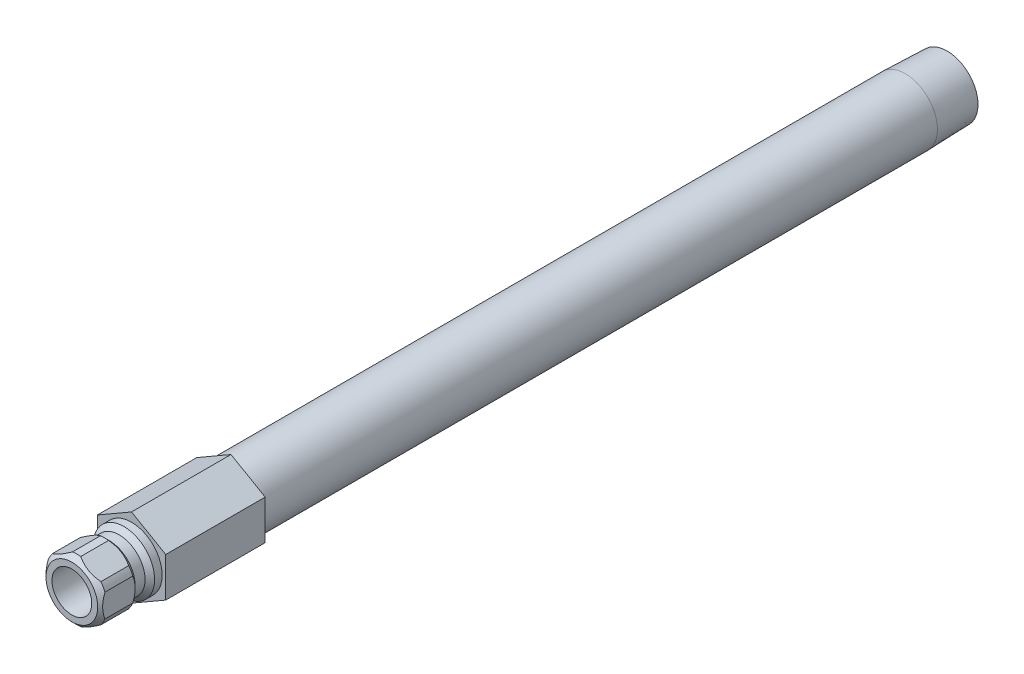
SolidWorks part; units mm, degrees
ref_plane "Front Plane" through (0, 0, 0) normal (0, 0, 1) x (1, 0, 0)
ref_plane "Top Plane" through (0, 0, 0) normal (0, 1, 0) x (1, 0, 0)
ref_plane "Right Plane" through (0, 0, 0) normal (1, 0, 0) x (0, 0, -1)
sketch "Sketch1" plane through (0, 0, 0) normal (1, 0, 0) x (0, 0, -1)
  line L0 (0, 0) -> (-12.7, 0) construction
  line L1 (-9.525, 3.175) -> (-9.525, 4.1275)
  line L2 (-3.556, 4.1275) -> (-3.556, 0) construction
  line L3 (-8.763, 4.8895) -> (-4.318, 4.8895)
  line L4 (0, 5.1435) -> (0, 3.4163) construction
  line L5 (-3.556, 4.1275) -> (-1.9685, 4.1275)
  line L6 (-1.2065, 4.8895) -> (0, 4.8895)
  line L7 (0, 4.8895) -> (0, 5.1435)
  line L8 (-3.556, 4.1275) -> (-4.318, 4.8895)
  line L9 (-1.9685, 4.1275) -> (-1.2065, 4.8895)
  line L10 (-9.525, 4.1275) -> (-8.763, 4.8895)
  line L12 (0, 5.1435) -> (123.4948, 5.1435)
  line L13 (123.4948, 5.1435) -> (130.175, 4.9347)
  line L14 (130.175, 4.9347) -> (130.175, 2.3813)
  line L15 (0, 0) -> (15.875, 0) construction
  line L16 (15.875, 0) -> (15.875, 4.8895) construction
  line L17 (15.875, 4.8895) -> (0, 4.8895) construction
  line L18 (0.127, 2.3813) -> (130.175, 2.3813)
  line L19 (0.127, 3.175) -> (-9.525, 3.175)
  line L20 (0, 3.175) -> (0, 0) construction
  line L21 (0.127, 2.3813) -> (0.127, 3.175)
  dimension "D1" = 9.525
  dimension "D2" = 1.5875
  dimension "D3" = 0.762
  dimension "D4" = 45
  dimension "D5" = 5.969
  dimension "D6" = 45
  dimension "D7" = 1.79
  dimension "D8" = 6.6802
  dimension "D9" = 139.7
  dimension "D10" = 3.175
  dimension "D11" = 25.4
  dimension "D12" = 4.7625
  dimension "D13" = 6.35
  dimension "D14" = 9.779
  dimension "D15" = 10.287
  dimension "D16" = 9.652
revolve "Revolve1" add sketch "Sketch1" angle 360 about L0
sketch "Sketch2" plane through (0, 0, 0) normal (0, 0, 1) x (1, 0, 0)
  line L1 (-5.461, 3.1529) -> (-5.461, -3.1529)
  line L2 (-5.461, -3.1529) -> (0, -6.3058)
  line L3 (0, -6.3058) -> (5.461, -3.1529)
  line L4 (5.461, -3.1529) -> (5.461, 3.1529)
  line L5 (5.461, 3.1529) -> (0, 6.3058)
  line L6 (0, 6.3058) -> (-5.461, 3.1529)
  circle A0 centre (0, 0) radius 5.461 construction
  circle A1 centre (0, 0) radius 2.3812 construction
  circle A2 centre (0, 0) radius 2.3812
  dimension "D1" = 10.922
extrude "Boss-Extrude1" add sketch "Sketch2" against normal up to vertex (15.875 mm away) from vertex at 0
sketch "Sketch3" plane through (0, 0, 0) normal (0, 0, 1) x (1, 0, 0)
  line L1 (-4.5212, -2.6103) -> (0, -5.2206)
  line L2 (0, -5.2206) -> (4.5212, -2.6103)
  line L3 (4.5212, -2.6103) -> (4.5212, 2.6103)
  line L4 (4.5212, 2.6103) -> (0, 5.2206)
  line L5 (0, 5.2206) -> (-4.5212, 2.6103)
  line L6 (-4.5212, 2.6103) -> (-4.5212, -2.6103)
  circle A0 centre (0, 0) radius 4.5212 construction
  dimension "D1" = 9.0424
extrude "Cut-Extrude1" cut sketch "Sketch3" along normal through all from vertex at 3.556 flip side to cut
